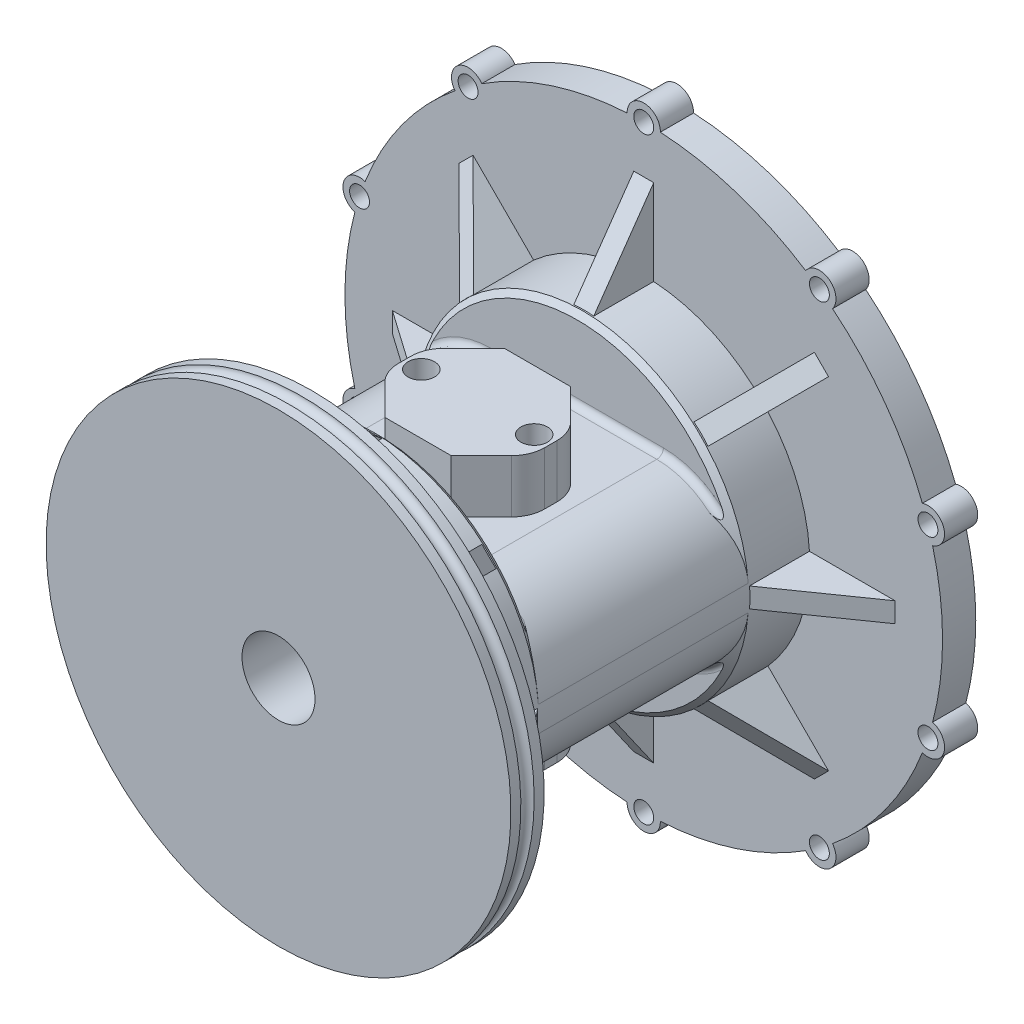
SolidWorks part; units mm, degrees
ref_plane "Front Plane" through (0, 0, 0) normal (0, 0, 1) x (1, 0, 0)
ref_plane "Top Plane" through (0, 0, 0) normal (0, 1, 0) x (1, 0, 0)
ref_plane "Right Plane" through (0, 0, 0) normal (1, 0, 0) x (0, 0, -1)
sketch "Sketch1" plane through (0, 0, 0) normal (0, 0, 1) x (1, 0, 0)
  circle A0 centre (0, 0) radius 45
  dimension "D1" = 90
extrude "Boss-Extrude1" add sketch "Sketch1" along normal blind 60
sketch "Sketch2" plane through (0, 0, 0) normal (1, 0, 0) x (0, 0, -1)
  line L0 (-5, 45) -> (-60, 45)
  line L1 (0, 45) -> (-60, 45) construction
  line L2 (-60, 45) -> (-60, 35)
  line L3 (-60, 45) -> (-60, -45) construction
  line L4 (-60, 35) -> (-55, 35)
  line L5 (-55, 35) -> (-55, 25)
  line L6 (-55, 25) -> (-5, 25)
  line L7 (-5, 25) -> (-5, 45)
  line L8 (0, 27.5) -> (-2, 27.5)
  line L9 (0, -45) -> (0, 45) construction
  line L10 (-2, 27.5) -> (-2, 5.5)
  line L11 (-2, 5.5) -> (-60, 5.5)
  line L12 (-60, 5.5) -> (-60, 0)
  line L13 (-60, 0) -> (0, 0)
  line L14 (0, 0) -> (0, 27.5)
  dimension "D1" = 5
  dimension "D2" = 2
  dimension "D3" = 25
  dimension "D4" = 5.5
  dimension "D5" = 35
  dimension "D6" = 5
  dimension "D7" = 27.5
revolve "Cut-Revolve1" cut sketch "Sketch2" angle 360 about L13
sketch "Sketch3" plane through (0, 0, 0) normal (1, 0, 0) x (0, 0, -1)
  line L0 (-5, 37.8533) -> (-14, 25)
  line L1 (-5, 45) -> (-5, -45) construction
  line L2 (-5, 25) -> (-55, 25) construction
  line L3 (-14, 25) -> (9.7098, 25) construction
  line L4 (-60, 35) -> (-60, -35) construction
  dimension "D1" = 55
  dimension "D2" = 46
rib "Rib1" sketch "Sketch3" sketch "Sketch3" thickness 3 extrusion direction parallel to sketch draft on no parameters "D1"=3
sketch "Sketch4" plane through (0, 0, 0) normal (1, 0, 0) x (0, 0, -1)
  line L0 (-55, 32.5519) -> (-46, 25)
  line L2 (-55, -35) -> (-55, 35) construction
  line L3 (-14, 25) -> (-55, 25) construction
  line L4 (-46, 25) -> (-64.258, 25) construction
  line L5 (-60, 35) -> (-60, -35) construction
  dimension "D1" = 40
  dimension "D2" = 14
rib "Rib2" sketch "Sketch4" sketch "Sketch4" thickness 3 extrusion direction parallel to sketch draft on no parameters "D1"=3
pattern_circular "CirPattern1" count 8 over 360 about axis through (0, 0, 0) along (0, 0, 1) of "Rib1", "Rib2"
sketch "Sketch5" plane through (0, 0, 0) normal (1, 0, 0) x (0, 0, -1)
  line L0 (-14, 25) -> (-46, 25) construction
  line L1 (-15, 25) -> (-21, 25)
  line L2 (-15, 25) -> (-15, 13)
  line L3 (-15, 13) -> (-21, 13)
  line L4 (-21, 25) -> (-21, 13)
  line L5 (0, -45) -> (0, 45) construction
  line L6 (-39, 25) -> (-45, 25)
  line L7 (-39, 25) -> (-39, 13)
  line L8 (-39, 13) -> (-45, 13)
  line L9 (-45, 25) -> (-45, 13)
  line L10 (-60, 35) -> (-60, -35) construction
  line L11 (0, 0) -> (-34.4244, 0) construction
  line L12 (-45, -25) -> (-45, -13)
  line L13 (-39, -13) -> (-45, -13)
  line L14 (-39, -25) -> (-39, -13)
  line L15 (-39, -25) -> (-45, -25)
  line L16 (-21, -25) -> (-21, -13)
  line L17 (-15, -13) -> (-21, -13)
  line L18 (-15, -25) -> (-15, -13)
  line L19 (-15, -25) -> (-21, -25)
  dimension "D1" = 6
  dimension "D2" = 15
  dimension "D3" = 12
  dimension "D4" = 15
  dimension "D5" = 12
extrude "Cut-Extrude1" cut sketch "Sketch5" against normal mid plane 60
sketch "Sketch6" plane through (0, 0, 39) normal (0, 0, 1) x (1, 0, 0)
  line L0 (-11, 13) -> (-11, 21)
  line L1 (-21.3542, 13) -> (21.3542, 13) construction
  line L2 (-11, 21) -> (11, 21)
  line L3 (11, 21) -> (11, 13)
  line L4 (11, 13) -> (27.1621, 13)
  line L5 (27.1621, 13) -> (27.1621, 30.0636)
  line L6 (27.1621, 30.0636) -> (-25.0964, 30.0636)
  line L7 (-25.0964, 30.0636) -> (-25.0964, 13)
  line L8 (-25.0964, 13) -> (-11, 13)
  line L9 (0, 0) -> (-17.3753, 0) construction
  line L10 (-25.0964, -13) -> (-11, -13)
  line L11 (-25.0964, -30.0636) -> (-25.0964, -13)
  line L12 (27.1621, -30.0636) -> (-25.0964, -30.0636)
  line L13 (27.1621, -13) -> (27.1621, -30.0636)
  line L14 (11, -13) -> (27.1621, -13)
  line L15 (11, -21) -> (11, -13)
  line L16 (-11, -21) -> (11, -21)
  line L17 (-11, -13) -> (-11, -21)
  dimension "D1" = 22
  dimension "D2" = 11
  dimension "D3" = 8
extrude "Cut-Extrude2" cut sketch "Sketch6" against normal up to surface (18 mm away)
chamfer "Chamfer1" distance 0.8 angle 45 4 edges at (0, -25, 45) (0, 25, 45) (0, -25, 15) (0, 25, 15)
chamfer "Chamfer2" distance 6 angle 45 8 edges at (11, -17, 39) (11, -17, 21) (-11, -17, 39) (-11, -17, 21) (11, 17, 21) (-11, 17, 21) (11, 17, 39) (-11, 17, 39)
fillet "Fillet1" radius 5 8 edges at (11, -17, 33) (11, -17, 27) (11, 17, 27) (11, 17, 33) (-11, -17, 33) (-11, -17, 27) (-11, 17, 33) (-11, 17, 27)
sketch "Sketch8" plane through (0, -21, 0) normal (0, -1, 0) x (1, 0, 0)
  line L0 (11, 29.0711) -> (11, 30.9289) construction
  line L1 (-11, 29.0711) -> (-11, 30.9289) construction
  line L2 (-11, 30) -> (-8.5, 30) construction
  line L3 (-11, 29.0711) -> (-11, 30.9289) construction
  circle A0 centre (-8.5, 30) radius 2
  circle A1 centre (8.5, 30) radius 2
  point P4 (11, 30)
  point P7 (-11, 30)
  dimension "D1" = 4
  dimension "D2" = 2.5
  dimension "D3" = 2.5
extrude "Cut-Extrude3" cut sketch "Sketch8" against normal through all
sketch "Sketch9" plane through (0, 0, 0) normal (0, 0, -1) x (-1, 0, 0)
  line L0 (0, 0) -> (0, 45) construction
  circle A0 centre (0, 45) radius 2.5
  circle A1 centre (0, 0) radius 45 construction
  circle A2 centre (26.4503, 36.4058) radius 2.5
  circle A3 centre (42.7975, 13.9058) radius 2.5
  circle A4 centre (42.7975, -13.9058) radius 2.5
  circle A5 centre (26.4503, -36.4058) radius 2.5
  circle A6 centre (0, -45) radius 2.5
  circle A7 centre (-26.4503, -36.4058) radius 2.5
  circle A8 centre (-42.7975, -13.9058) radius 2.5
  circle A9 centre (-42.7975, 13.9058) radius 2.5
  circle A10 centre (-26.4503, 36.4058) radius 2.5
  point P24 (0, 0)
  dimension "D1" = 5
  dimension "D2" = 10
extrude "Boss-Extrude2" add sketch "Sketch9" against normal up to surface (5 mm away)
sketch "Sketch11" plane through (0, 0, 0) normal (0, 0, -1) x (-1, 0, 0)
  circle A0 centre (0, 45) radius 1.5
  circle A1 centre (26.4503, 36.4058) radius 1.5
  circle A2 centre (42.7975, 13.9058) radius 1.5
  circle A3 centre (42.7975, -13.9058) radius 1.5
  circle A4 centre (26.4503, -36.4058) radius 1.5
  circle A5 centre (0, -45) radius 1.5
  circle A6 centre (-26.4503, -36.4058) radius 1.5
  circle A7 centre (-42.7975, -13.9058) radius 1.5
  circle A8 centre (-42.7975, 13.9058) radius 1.5
  circle A9 centre (-26.4503, 36.4058) radius 1.5
  point P24 (0, 0)
  dimension "D1" = 3
  dimension "D2" = 10
extrude "Cut-Extrude4" cut sketch "Sketch11" against normal blind 60
sketch "Sketch12" plane through (0, 0, 0) normal (0, 1, 0) x (1, 0, 0)
  line L0 (35, -60) -> (35, -55) construction
  line L1 (0, -60) -> (0, -52.6342) construction
  line L2 (-35, -60) -> (35, -60) construction
  circle A0 centre (35, -57.5) radius 1
  dimension "D1" = 2
revolve "Cut-Revolve2" cut sketch "Sketch12" angle 360 about L1
fillet "Fillet2" radius 12 4 edges at (-21.3542, -13, 30) (21.3542, -13, 30) (21.3542, 13, 30) (-21.3542, 13, 30)
fillet "Fillet3" radius 1 12 edges at (-18.641, -11.5708, 45) (18.641, -11.5708, 45) (-18.641, 11.5708, 45) (18.641, 11.5708, 45) (18.641, -11.5708, 15) (0, -13, 15) (-18.641, 11.5708, 15) (18.641, 11.5708, 15) (0, -13, 45) (0, 13, 45) (-18.641, -11.5708, 15) (0, 13, 15)
